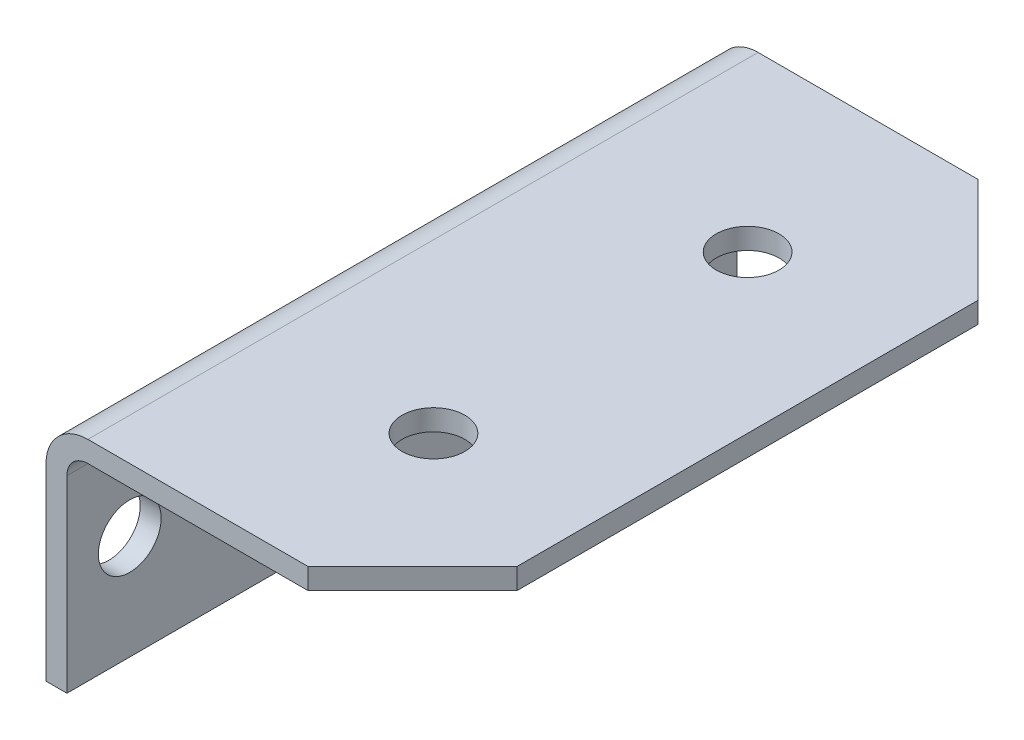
SolidWorks part; units mm, degrees
ref_plane "Plan de face" through (0, 0, 0) normal (0, 0, 1) x (1, 0, 0)
ref_plane "Plan de dessus" through (0, 0, 0) normal (0, 1, 0) x (1, 0, 0)
ref_plane "Plan de droite" through (0, 0, 0) normal (1, 0, 0) x (0, 0, -1)
sketch "Esquisse1" plane through (0, 0, 0) normal (0, 0, 1) x (1, 0, 0)
  line L0 (0, 0) -> (0, 22)
  line L1 (0, 22) -> (35, 22)
  line L2 (35, 22) -> (35, 20)
  line L3 (35, 20) -> (2, 20)
  line L4 (2, 20) -> (2, 0)
  line L5 (2, 0) -> (0, 0)
  dimension "D1" = 2
  dimension "D2" = 2
  dimension "D3" = 22
  dimension "D4" = 35
extrude "Extrusion1" add sketch "Esquisse1" along normal blind 64
fillet "Congé1" radius 2 1 edges at (2, 20, 32)
fillet "Congé2" radius 4 1 edges at (0, 22, 32)
sketch "Esquisse2" plane through (2, 0, 0) normal (1, 0, 0) x (0, 0, -1)
  line L0 (-64, 0) -> (-64, 18) construction
  line L1 (-64, 0) -> (0, 0) construction
  circle A0 centre (-58, 10) radius 3
  circle A1 centre (-6, 10) radius 3
  dimension "D2" = 6
  dimension "D3" = 10
  dimension "D4" = 10
  dimension "D5" = 6
  dimension "D6" = 6
  dimension "D1" = 52
extrude "Enlèv. mat.-Extru.1" cut sketch "Esquisse2" against normal blind 10
sketch "Esquisse3" plane through (0, 22, 0) normal (0, 1, 0) x (-1, 0, 0)
  line L0 (-35, 64) -> (-4, 64) construction
  line L2 (0, 64) -> (0, 0) construction
  circle A0 centre (-20, 17) radius 3
  circle A1 centre (-20, 47) radius 3
  dimension "D1" = 6
  dimension "D2" = 6
  dimension "D3" = 30
  dimension "D4" = 17
  dimension "D5" = 20
  dimension "D6" = 20
extrude "Enlèv. mat.-Extru.2" cut sketch "Esquisse3" against normal blind 10
chamfer "Chanfrein1" distance 10 angle 45 2 edges at (35, 21, 0) (35, 21, 64)
